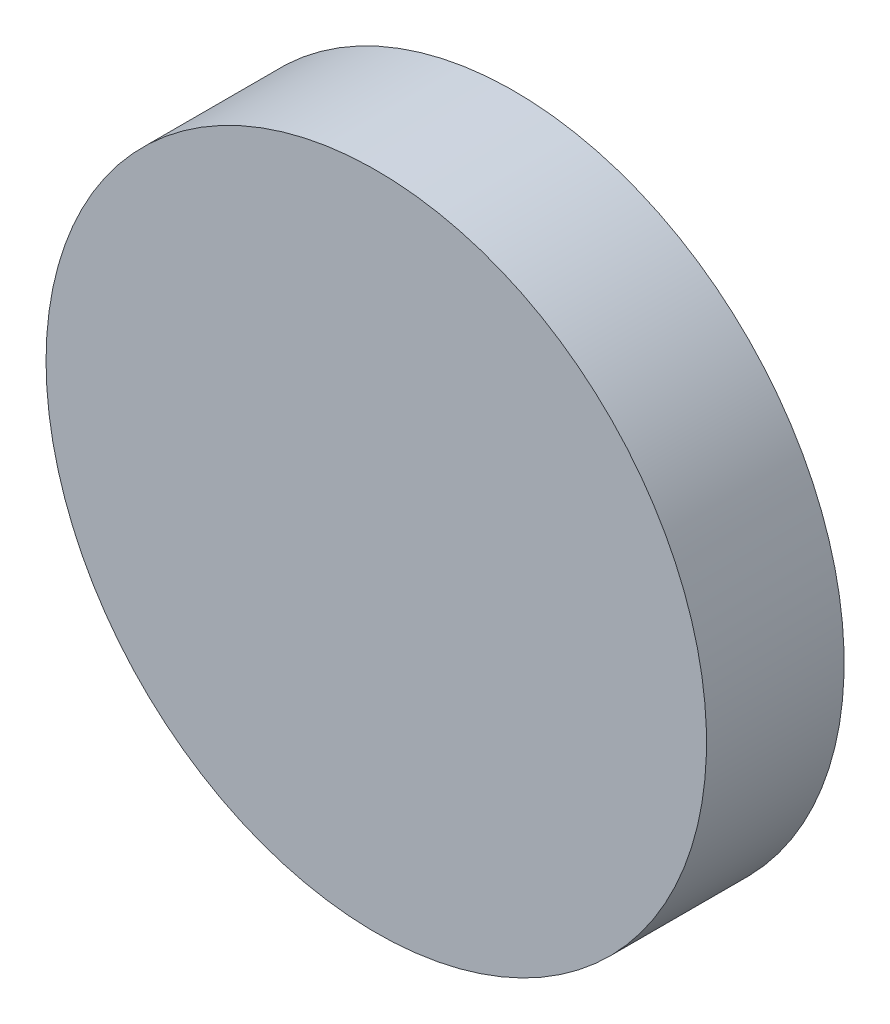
SolidWorks part; units mm, degrees
ref_plane "Front Plane" through (0, 0, 0) normal (0, 0, 1) x (1, 0, 0)
ref_plane "Top Plane" through (0, 0, 0) normal (0, 1, 0) x (1, 0, 0)
ref_plane "Right Plane" through (0, 0, 0) normal (1, 0, 0) x (0, 0, -1)
sketch "Sketch1" plane through (0, 0, 0) normal (0, 0, 1) x (1, 0, 0)
  circle A0 centre (0, 0) radius 22.86
  dimension "D1" = 45.72
extrude "Boss-Extrude1" add sketch "Sketch1" along normal blind 9.525
